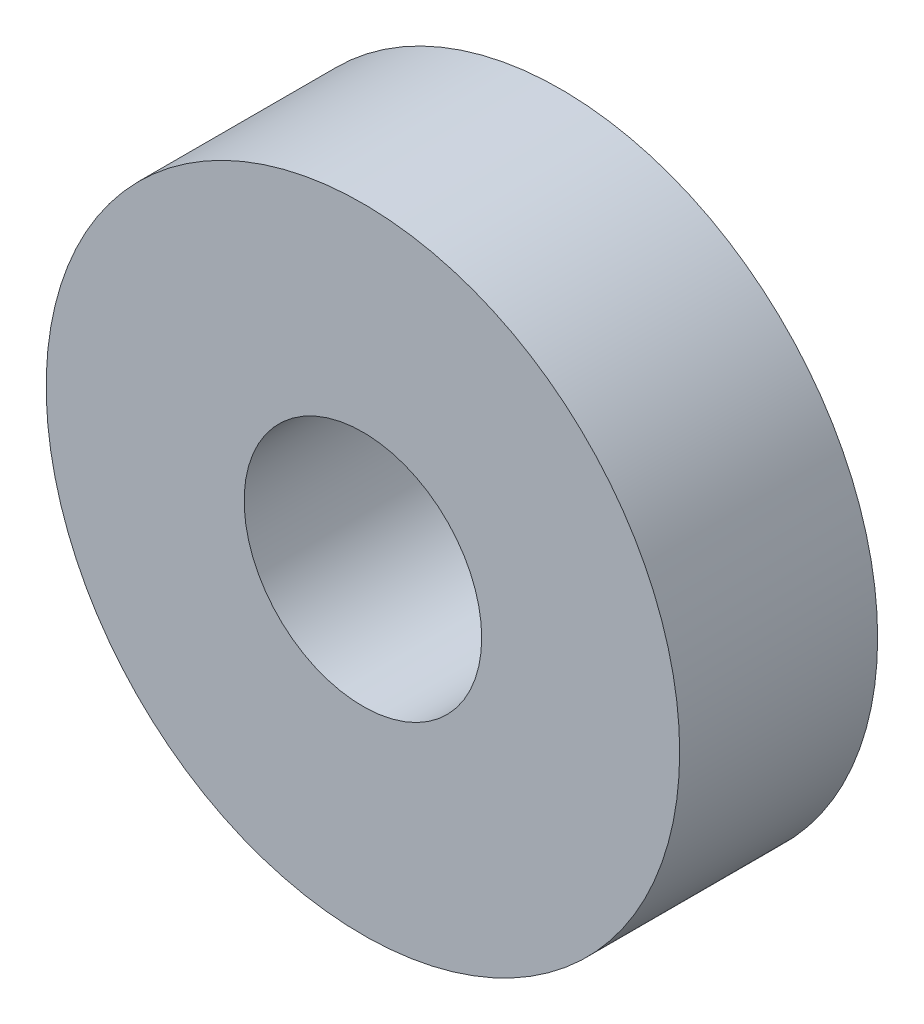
SolidWorks part; units mm, degrees
ref_plane "Alzado" through (0, 0, 0) normal (0, 0, 1) x (1, 0, 0)
ref_plane "Planta" through (0, 0, 0) normal (0, 1, 0) x (1, 0, 0)
ref_plane "Vista lateral" through (0, 0, 0) normal (1, 0, 0) x (0, 0, -1)
sketch "Croquis1" plane through (0, 0, 0) normal (0, 0, 1) x (1, 0, 0)
  circle A0 centre (0, 0) radius 16
  circle A1 centre (0, 0) radius 6
extrude "Extruir1" add sketch "Croquis1" along normal blind 10
